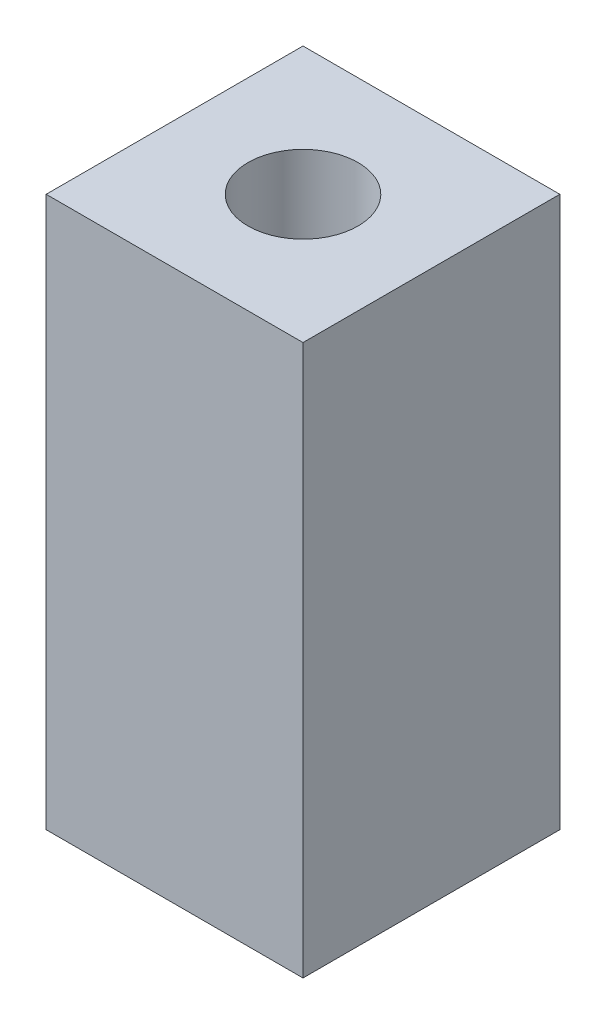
SolidWorks part; units mm, degrees
ref_plane "Front Plane" through (0, 0, 0) normal (0, 0, 1) x (1, 0, 0)
ref_plane "Top Plane" through (0, 0, 0) normal (0, 1, 0) x (1, 0, 0)
ref_plane "Right Plane" through (0, 0, 0) normal (1, 0, 0) x (0, 0, -1)
sketch "Sketch1" plane through (0, 0, 0) normal (0, 1, 0) x (1, 0, 0)
  line L1 (-3.5, -3.5) -> (3.5, -3.5)
  line L2 (-3.5, -3.5) -> (-3.5, 3.5)
  line L3 (-3.5, 3.5) -> (3.5, 3.5)
  line L4 (3.5, -3.5) -> (3.5, 3.5)
  line L5 (-3.5, -3.5) -> (3.5, 3.5) construction
  line L6 (-3.5, 3.5) -> (3.5, -3.5) construction
  circle A0 centre (0, 0) radius 1.5
  point P0 (0, 0)
  dimension "D3" = 3
  dimension "D1" = 7
  dimension "D2" = 7
extrude "Boss-Extrude1" add sketch "Sketch1" along normal blind 15
